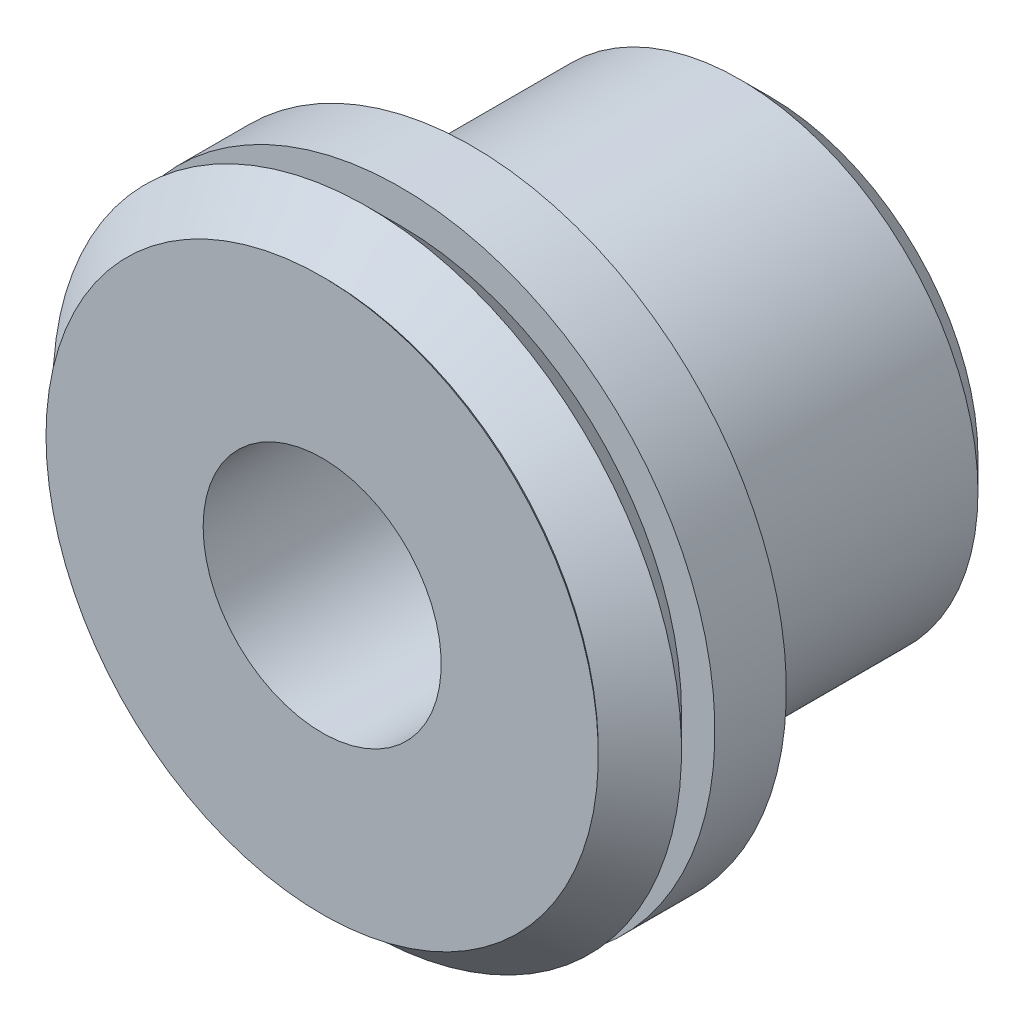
SolidWorks part; units mm, degrees
ref_plane "Front" through (0, 0, 0) normal (0, 0, 1) x (1, 0, 0)
ref_plane "Top" through (0, 0, 0) normal (0, 1, 0) x (1, 0, 0)
ref_plane "Right" through (0, 0, 0) normal (1, 0, 0) x (0, 0, -1)
ref_plane "Body Plane" through (0, 0, -3.9982) normal (0, 0, 1) x (1, 0, 0)
sketch "Sketch1" plane through (0, 0, 0) normal (1, 0, 0) x (0, 0, -1)
  line L0 (71.2941, 0) -> (-67.6458, 0) construction
  line L1 (0, 0) -> (0, 7.366)
  line L2 (0, 7.366) -> (0.0927, 7.2733)
  line L3 (0.0927, 7.2733) -> (1.2014, 8.382)
  line L4 (1.2014, 8.382) -> (2.0932, 7.4902)
  line L5 (2.0932, 7.4902) -> (2.0932, 8.382)
  line L6 (2.0932, 8.382) -> (3.9982, 8.382)
  line L7 (3.9982, 8.382) -> (3.9982, 0)
  line L8 (3.9982, 0) -> (0, 0)
  dimension "D1" = 45
  dimension "D2" = 8.382
  dimension "D3" = 8.382
  dimension "D4" = 0.8918
  dimension "D5" = 1.2014
  dimension "D6" = 7.366
  dimension "Front Length" = 1.905
revolve "Base" add sketch "Sketch1" angle 360 about L0
sketch "Sketch15" plane through (0, 0, -3.9982) normal (0, 0, 1) x (1, 0, 0)
  circle A0 centre (0, 0) radius 6.35
  dimension "D1" = 12.7
extrude "Single Acting Stud" add sketch "Sketch15" against normal blind 7.9375
chamfer "Single Acting Stud Chamfer" distance 0.7937 angle 45 1 edges at (6.35, 0, -11.9357)
sketch "Sketch3" plane through (0, 0, 0) normal (0, 0, -1) x (-1, 0, 0)
  circle A0 centre (0, 0) radius 3.175
  dimension "D1" = 6.35
extrude "Hole Cut" cut sketch "Sketch3" along normal through all
